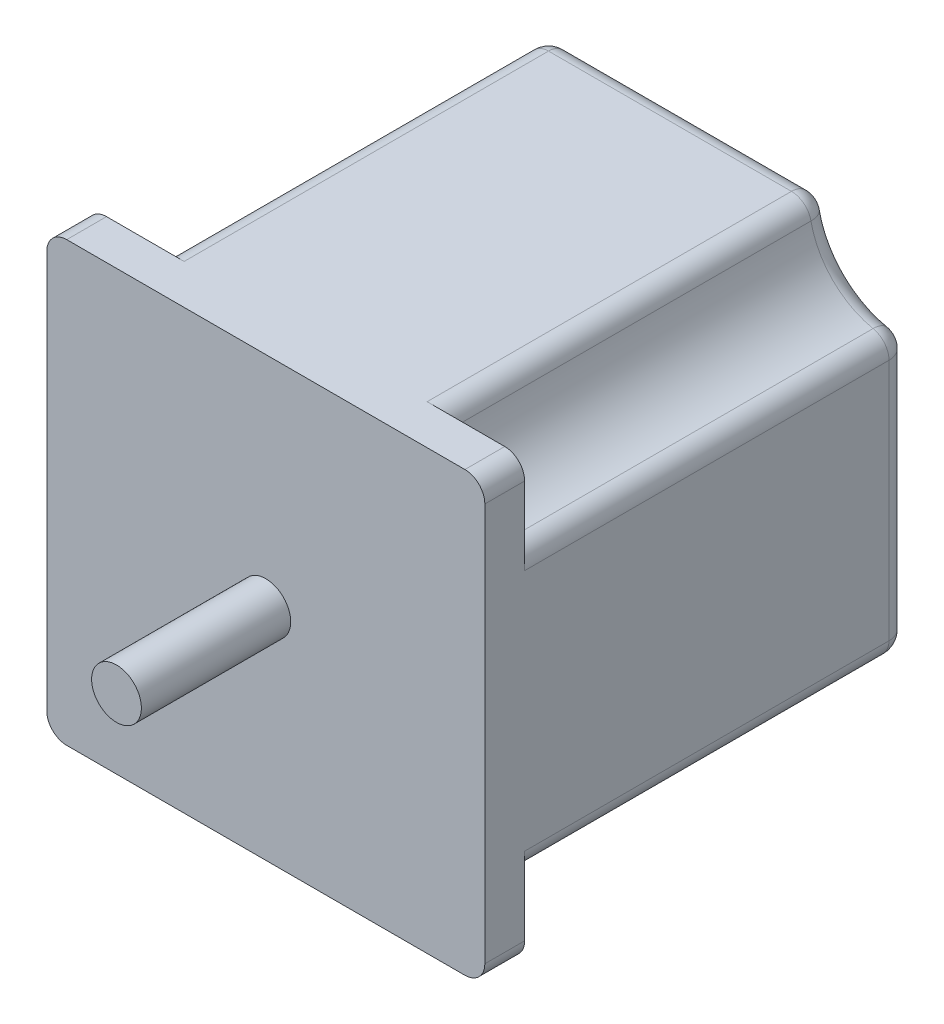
SolidWorks part; units mm, degrees
ref_plane "Front Plane" through (0, 0, 0) normal (0, 0, 1) x (1, 0, 0)
ref_plane "Top Plane" through (0, 0, 0) normal (0, 1, 0) x (1, 0, 0)
ref_plane "Right Plane" through (0, 0, 0) normal (1, 0, 0) x (0, 0, -1)
sketch "Sketch2" plane through (0, 0, 0) normal (0, 0, 1) x (1, 0, 0)
  line L0 (27.94, 55.88) -> (27.94, 0) construction
  line L1 (10.16, 0) -> (45.72, 0)
  line L2 (0, 10.16) -> (0, 45.72)
  line L3 (10.16, 55.88) -> (45.72, 55.88)
  line L4 (55.88, 10.16) -> (55.88, 45.72)
  line L5 (55.88, 27.94) -> (0, 27.94) construction
  arc A0 (45.72, 55.88) -> (55.88, 45.72) centre (55.88, 55.88) ccw
  arc A1 (45.72, 0) -> (55.88, 10.16) centre (55.88, 0) cw
  arc A2 (10.16, 0) -> (0, 10.16) centre (0, 0) ccw
  arc A3 (10.16, 55.88) -> (0, 45.72) centre (0, 55.88) cw
  dimension "D1" = 55.88
  dimension "D2" = 55.88
extrude "Boss-Extrude1" add sketch "Sketch2" along normal blind 54.102
sketch "Sketch3" plane through (0, 0, 54.102) normal (0, 0, 1) x (1, 0, 0)
  line L1 (55.88, 55.88) -> (0, 55.88)
  line L2 (55.88, 55.88) -> (55.88, 0)
  line L3 (55.88, 0) -> (0, 0)
  line L4 (0, 55.88) -> (0, 0)
extrude "Boss-Extrude2" add sketch "Sketch3" against normal blind 5.08
fillet "Fillet1" radius 2.54 20 edges at (10.16, 55.88, 24.511) (0, 45.72, 24.511) (0, 10.16, 24.511) (10.16, 0, 24.511) (0, 0, 51.562) (0, 55.88, 51.562) (45.72, 0, 24.511) (55.88, 0, 51.562) (55.88, 10.16, 24.511) (55.88, 45.72, 24.511) (45.72, 55.88, 24.511) (55.88, 55.88, 51.562) (55.88, 27.94, 0) (48.6958, 7.1842, 0) (27.94, 0, 0) (7.1842, 7.1842, 0) (0, 27.94, 0) (7.1842, 48.6958, 0) (48.6958, 48.6958, 0) (27.94, 55.88, 0)
sketch "Sketch4" plane through (0, 0, 54.102) normal (0, 0, 1) x (1, 0, 0)
  line L0 (55.1361, 55.1361) -> (0.7439, 0.7439) construction
  line L1 (0.7439, 0.7439) -> (0.7439, 55.1361) construction
  line L2 (0.7439, 55.1361) -> (55.1361, 0.7439) construction
  arc A0 (55.88, 53.34) -> (53.34, 55.88) centre (53.34, 53.34) ccw construction
  arc A1 (0, 2.54) -> (2.54, 0) centre (2.54, 2.54) ccw construction
  arc A2 (2.54, 55.88) -> (0, 53.34) centre (2.54, 53.34) ccw construction
  arc A3 (53.34, 0) -> (55.88, 2.54) centre (53.34, 2.54) ccw construction
  circle A4 centre (27.94, 27.94) radius 3.175
extrude "Boss-Extrude3" add sketch "Sketch4" along normal blind 19.05
